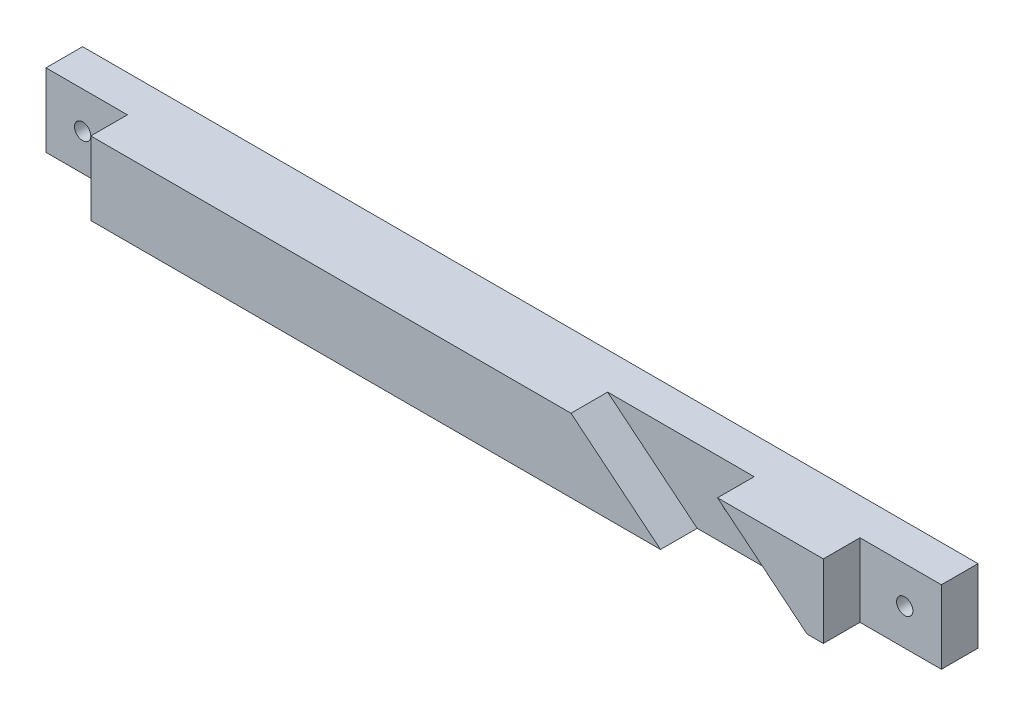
SolidWorks part; units mm, degrees
ref_plane "Face" through (0, 0, 0) normal (0, 0, 1) x (1, 0, 0)
ref_plane "Dessus" through (0, 0, 0) normal (0, 1, 0) x (1, 0, 0)
ref_plane "Droite" through (0, 0, 0) normal (1, 0, 0) x (0, 0, -1)
sketch "Esquisse1" plane through (0, 0, 0) normal (0, 0, 1) x (1, 0, 0)
  line L1 (-67.2717, -109.6176) -> (42.7283, -109.6176)
  line L2 (-67.2717, -109.6176) -> (-67.2717, -100.6176)
  line L3 (-67.2717, -100.6176) -> (42.7283, -100.6176)
  line L4 (42.7283, -109.6176) -> (42.7283, -100.6176)
  dimension "D1" = 110
  dimension "D2" = 9
extrude "Extrusion1" add sketch "Esquisse1" along normal blind 9
sketch "Esquisse2" plane through (0, 0, 9) normal (0, 0, 1) x (1, 0, 0)
  line L0 (42.7283, -100.6176) -> (-67.2717, -100.6176) construction
  line L1 (-67.2717, -109.6176) -> (-57.2717, -109.6176)
  line L2 (-67.2717, -109.6176) -> (-67.2717, -100.6176)
  line L3 (-67.2717, -100.6176) -> (-57.2717, -100.6176)
  line L4 (-57.2717, -109.6176) -> (-57.2717, -100.6176)
  line L6 (42.7283, -109.6176) -> (32.7283, -109.6176)
  line L7 (42.7283, -109.6176) -> (42.7283, -100.6176)
  line L8 (42.7283, -100.6176) -> (32.7283, -100.6176)
  line L9 (32.7283, -109.6176) -> (32.7283, -100.6176)
  dimension "D1" = 10
  dimension "D2" = 10
extrude "Enlèv. mat.-Extru.1" cut sketch "Esquisse2" against normal blind 4.5
sketch "Esquisse4" plane through (0, 0, 4.5) normal (0, 0, 1) x (1, 0, 0)
  line L0 (42.7283, -109.6176) -> (42.7283, -100.6176) construction
  line L1 (32.7283, -109.6176) -> (42.7283, -109.6176) construction
  circle A0 centre (38.2284, -105.1454) radius 1
  point P2 (42.7283, -105.1176)
  point P5 (37.7283, -109.6176)
  dimension "D3" = 2
  dimension "D1" = 4.5
  dimension "D2" = 4.5
extrude "Enlèv. mat.-Extru.2" cut sketch "Esquisse4" against normal blind 4.5
sketch "Esquisse5" plane through (0, 0, 4.5) normal (0, 0, 1) x (1, 0, 0)
  line L0 (-67.2717, -109.6176) -> (-57.2717, -109.6176) construction
  line L1 (-67.2717, -100.6176) -> (-67.2717, -109.6176) construction
  circle A0 centre (-62.7717, -105.1176) radius 1
  dimension "D1" = 2
  dimension "D2" = 4.5
  dimension "D3" = 4.5
extrude "Enlèv. mat.-Extru.3" cut sketch "Esquisse5" against normal blind 4.5
sketch "Esquisse6" plane through (0, 0, 9) normal (0, 0, 1) x (1, 0, 0)
  line L0 (30.7283, -109.6176) -> (19.7283, -100.6176)
  line L1 (-57.2717, -109.6176) -> (32.7283, -109.6176) construction
  line L2 (32.7283, -100.6176) -> (-57.2717, -100.6176) construction
  line L3 (19.7283, -100.6176) -> (1.7283, -100.6176)
  line L4 (1.7283, -100.6176) -> (12.7283, -109.6176)
  line L5 (12.7283, -109.6176) -> (30.7283, -109.6176)
  dimension "D1" = 12
  dimension "D2" = 23
  dimension "D3" = 18
  dimension "D4" = 18
extrude "Enlèv. mat.-Extru.4" cut sketch "Esquisse6" against normal blind 4.5
sketch "Esquisse8" plane through (0, 0, 4.5) normal (0, 0, 1) x (1, 0, 0)
  line L0 (12.7283, -109.6176) -> (30.7283, -109.6176) construction
  line L2 (42.7283, -109.6176) -> (42.7283, -100.6176) construction
  circle A0 centre (16.7283, -105.1176) radius 1
  dimension "D3" = 2
  dimension "D1" = 4.5
  dimension "D2" = 26
extrude "Enlèv. mat.-Extru.5" cut sketch "Esquisse8" against normal blind 4.5
